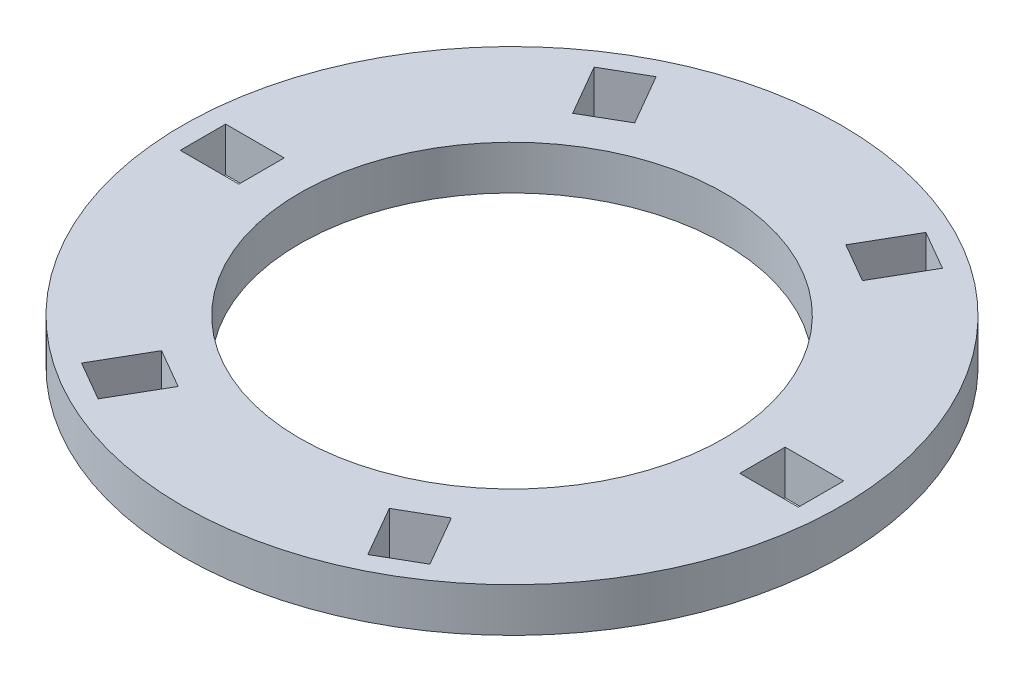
SolidWorks part; units mm, degrees
ref_plane "Front" through (0, 0, 0) normal (0, 0, 1) x (1, 0, 0)
ref_plane "Top" through (0, 0, 0) normal (0, 1, 0) x (1, 0, 0)
ref_plane "Right" through (0, 0, 0) normal (1, 0, 0) x (0, 0, -1)
sketch "Sketch1" plane through (0, 0, 0) normal (0, 1, 0) x (1, 0, 0)
  circle A0 centre (0, 0) radius 45
  dimension "D1" = 45
extrude "Boss-Extrude1" add sketch "Sketch1" along normal blind 6
sketch "Sketch2" plane through (0, 6, 0) normal (0, 1, 0) x (1, 0, 0)
  circle A0 centre (0, 0) radius 29
  dimension "D1" = 58
extrude "bearing bore" cut sketch "Sketch2" against normal through all
sketch "Sketch5" plane through (0, 6, 0) normal (0, 1, 0) x (1, 0, 0)
  line L0 (0, 0) -> (-42.2, 0) construction
  line L1 (-42.2, 3.1) -> (-34.2, 3.1)
  line L2 (-42.2, 3.1) -> (-42.2, -3.1)
  line L3 (-42.2, -3.1) -> (-34.2, -3.1)
  line L4 (-34.2, 3.1) -> (-34.2, -3.1)
  dimension "D1" = 6.2
  dimension "D2" = 8
  dimension "D3" = 34.2
extrude "wedge slot" cut sketch "Sketch5" against normal through all
pattern_circular "CirPattern1" count 6 over 360 about axis through (0, 0, 0) along (0, 1, 0) of "wedge slot"
sketch "Sketch4" plane through (0, 6, 0) normal (0, 1, 0) x (1, 0, 0)
  line L0 (0, 0) -> (36, 0) construction
  circle A0 centre (36, 0) radius 1.1303
  dimension "D2" = 2.2606
  dimension "D1" = 36
extrude "screw hole" [suppressed] cut sketch "Sketch4" against normal up to next and the other way through all
pattern_circular "screw pattern" [suppressed] count 6 over 360
